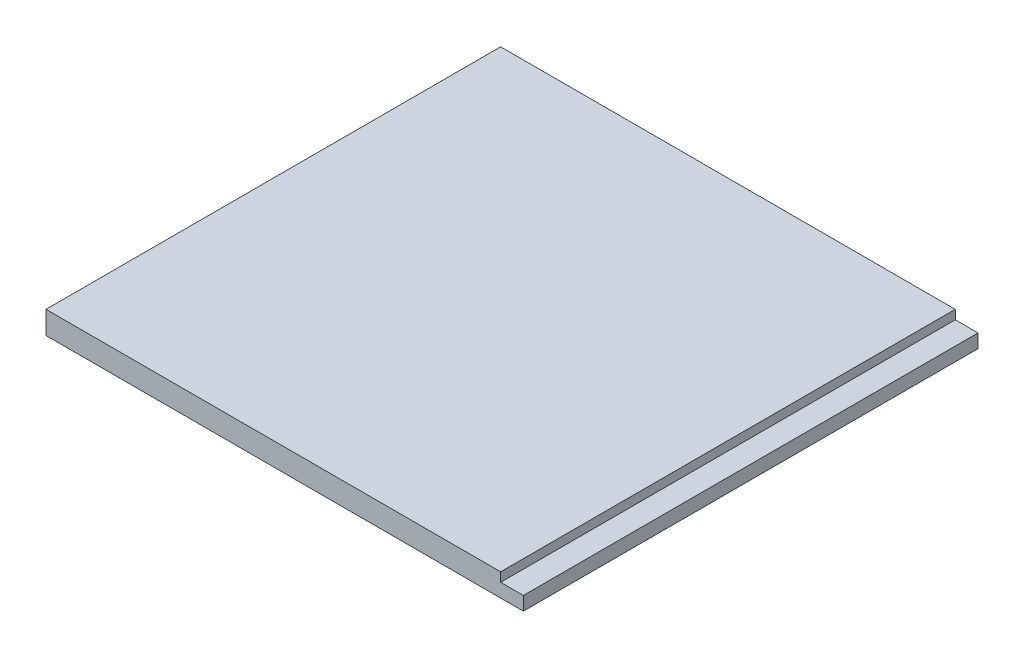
SolidWorks part; units mm, degrees
ref_plane "Plan de face" through (0, 0, 0) normal (0, 0, 1) x (1, 0, 0)
ref_plane "Plan de dessus" through (0, 0, 0) normal (0, 1, 0) x (1, 0, 0)
ref_plane "Plan de droite" through (0, 0, 0) normal (1, 0, 0) x (0, 0, -1)
sketch "Esquisse1" plane through (0, 0, 0) normal (0, 0, 1) x (1, 0, 0)
  line L0 (0, 0) -> (0, -1000)
  line L1 (0, -1000) -> (21000, -1000)
  line L2 (21000, -1000) -> (21000, -400)
  line L3 (20000, 0) -> (0, 0)
  line L4 (20000, 0) -> (20000, -400)
  line L5 (20000, -400) -> (21000, -400)
  arc A0 (21000, -400) -> (0, 0) centre (8606.1146, -99628.9857) ccw construction
  dimension "D4" = 100000
  dimension "D1" = 21000
  dimension "D2" = 1000
  dimension "D3" = 600
  dimension "D5" = 1000
  dimension "35000" = 20000
  dimension "D7" = 600
extrude "Boss.-Extru.1" add sketch "Esquisse1" along normal mid plane 20000
sketch "Esquisse2" plane through (0, -1000, 0) normal (0, 1, 0) x (1, 0, 0)
  line L0 (15000, 50) -> (15000, 200)
  line L1 (14900, -200) -> (15000, -200)
  line L2 (14900, -200) -> (14900, 200)
  line L3 (14900, 200) -> (15000, 200)
  line L4 (15000, -200) -> (15000, -50)
  line L5 (15000, 0) -> (14900, 0) construction
  arc A0 (15000, -50) -> (15000, 50) centre (15000, 0) ccw
  dimension "D1" = 100
  dimension "D2" = 15000
  dimension "D3" = 400
  dimension "D4" = 100
extrude "Enlèv. mat.-Extru.1" cut sketch "Esquisse2" along normal blind 100
sketch "Esquisse3" plane through (0, 0, 0) normal (0, 1, 0) x (1, 0, 0)
  line L0 (18917.5599, 0) -> (18917.5599, 5000) construction
  line L1 (18917.5599, 0) -> (18917.5599, 5000) construction
  line L2 (18917.5599, 5000) -> (18380.534, 5000) construction
  line L3 (18274.4701, 0) -> (23268.9548, 0) construction
  circle A0 centre (18917.5599, 5000) radius 5000
  point P0 (18917.5599, 5000)
  dimension "D2" = 10000
  dimension "D1" = 0
sketch "Esquisse4" plane through (0, -1000, 0) normal (0, -1, 0) x (1, 0, 0)
  point P0 (7140.3598, -6483.8033)
  point P1 (7058.9674, -1250.5683)
  point P2 (5352.169, -7379.5564)
  point P3 (5128.5363, 1602.0971)
  point P5 (4656.3062, 4958.0932)
  point P7 (12001.117, 7244.4138)
  point P9 (15337.0366, 5022.7936)
  point P11 (17471.765, -2548.6228)
  point P13 (13995.1895, -6483.8033)
  dimension "D1" = 2000
